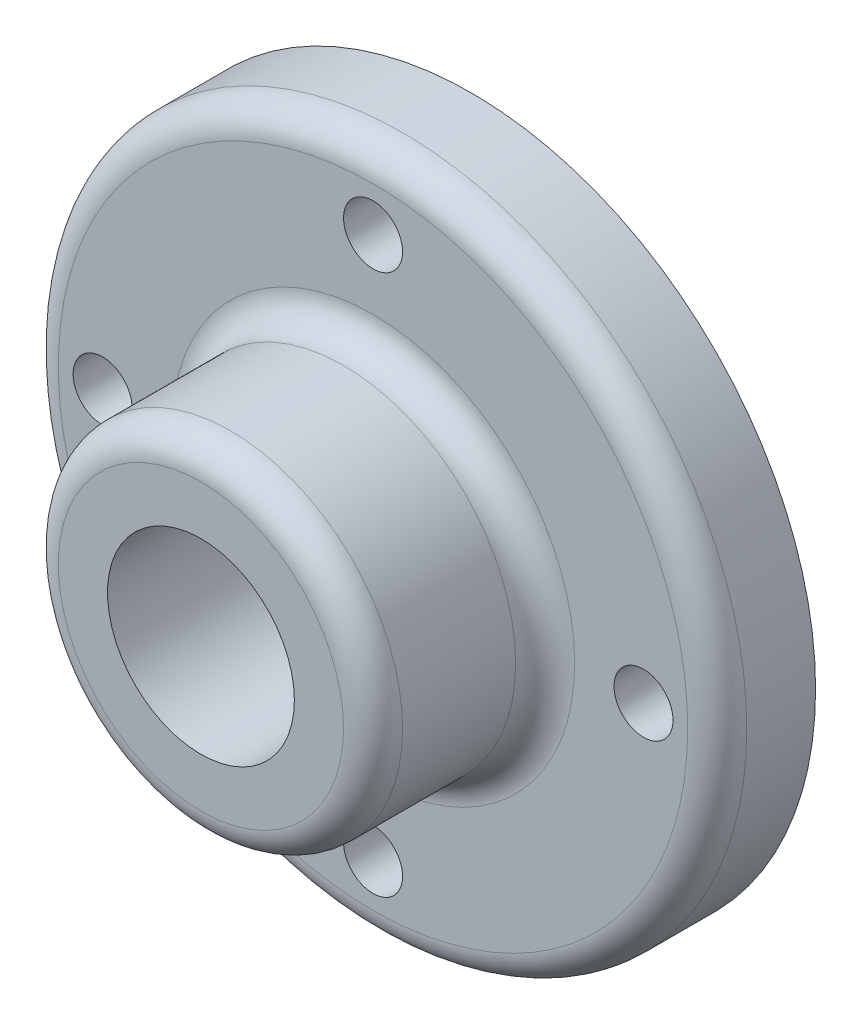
SolidWorks part; units mm, degrees
ref_plane "Front Plane" through (0, 0, 0) normal (0, 0, 1) x (1, 0, 0)
ref_plane "Top Plane" through (0, 0, 0) normal (0, 1, 0) x (1, 0, 0)
ref_plane "Right Plane" through (0, 0, 0) normal (1, 0, 0) x (0, 0, -1)
sketch "Sketch1" plane through (0, 0, 0) normal (0, 1, 0) x (1, 0, 0)
  line L0 (0, 0) -> (0, 85.9507) construction
  line L1 (19, 0) -> (19, 55)
  line L2 (19, 55) -> (70, 55)
  line L3 (70, 55) -> (70, 41)
  line L4 (64, 35) -> (41, 35)
  line L5 (35, 29) -> (35, 6)
  line L6 (29, 0) -> (19, 0)
  arc A0 (41, 35) -> (35, 29) centre (41, 29) ccw
  arc A1 (70, 41) -> (64, 35) centre (64, 41) cw
  arc A2 (35, 6) -> (29, 0) centre (29, 6) cw
  dimension "D6" = 6
  dimension "D1" = 140
  dimension "D2" = 70
  dimension "D3" = 55
  dimension "D4" = 20
  dimension "D5" = 38
revolve "Revolve1" add sketch "Sketch1" angle 360 about L0
hole_wizard "Ø12.0 (12) Diameter Hole1" positions "Sketch3" profile "Sketch2" hole size "Ø12.0" standard "ANSI Metric"
sketch "Sketch3" plane through (0, 0, -35) normal (0, 0, 1) x (1, 0, 0)
  circle A0 centre (0, 0) radius 55 construction
  point P0 (0, 55)
  point P2 (55, 0)
  point P4 (0, -55)
  point P6 (-55, 0)
  dimension "D1" = 110
sketch "Sketch2" plane through (0, 55, -35) normal (1, 0, 0) x (0, -1, 0)
  line L0 (0, 0) -> (0, 20)
  line L1 (0, 20) -> (6, 20)
  line L2 (6, 20) -> (6, 0)
  line L5 (6, 0) -> (0, 0)
  line L11 (0, -6.35) -> (0, 107.95) construction
  dimension "Thru Hole Dia." = 12
  dimension "Thru Hole Depth" = 20
